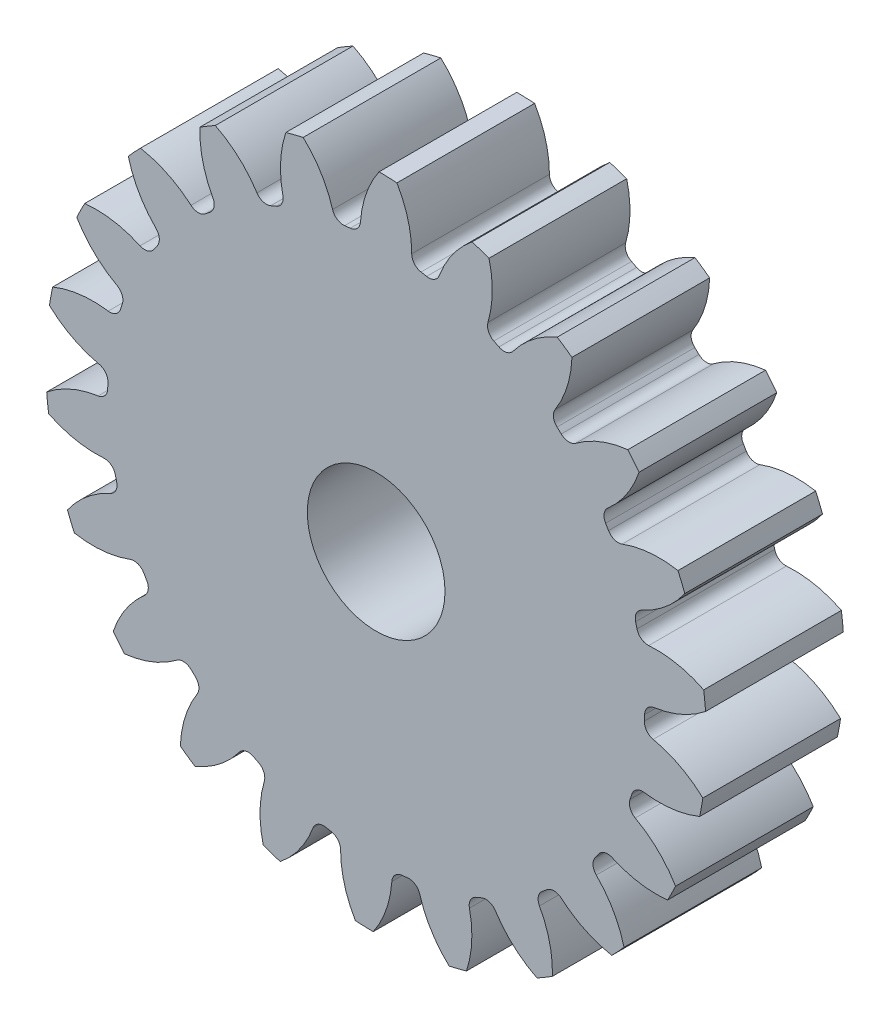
SolidWorks part; units mm, degrees
ref_plane "Front" through (0, 0, 0) normal (0, 0, 1) x (1, 0, 0)
ref_plane "Top" through (0, 0, 0) normal (0, 1, 0) x (1, 0, 0)
ref_plane "Right" through (0, 0, 0) normal (1, 0, 0) x (0, 0, -1)
sketch "Sketch3" plane through (0, 0, 0) normal (0, 0, 1) x (1, 0, 0)
  circle A0 centre (0, 0) radius 243.84
  dimension "od" = 487.68
extrude "gearBody" add sketch "Sketch3" along normal blind 101.6
sketch "Sketch2" plane through (0, 0, 0) normal (0, 0, 1) x (1, 0, 0)
  line L0 (0, 0) -> (194.0517, 80.3789) construction
  line L1 (241.7736, -37.5132) -> (0, 0) construction
  line L2 (0, 0) -> (36.3143, 0) construction
  line L3 (223.3803, 7.9014) -> (222.2401, -23.8861) construction
  line L5 (222.8102, -7.9924) -> (0, 0) construction
  line L7 (0, 0) -> (210.0401, 0) construction
  arc A0 (210.005, 3.8371) -> (209.1904, -18.8739) centre (0, 0) ccw construction
  arc A1 (243.0622, 19.4599) -> (241.0433, -36.8251) centre (0, 0) ccw construction
  arc A2 (223.3803, 7.9014) -> (222.2401, -23.8861) centre (0, 0) ccw construction
  arc A3 (197.9058, -9.2095) -> (198.057, -4.994) centre (0, 0) ccw
  arc A4 (241.7736, -37.5132) -> (204.4096, -17.6752) centre (187.7939, -94.0759) ccw
  arc A5 (241.7736, -37.5132) -> (243.84, 20.0939) centre (0, 0) ccw
  arc A6 (243.84, 20.0939) -> (205.1507, 2.984) centre (194.0517, 80.3789) cw
  arc A7 (198.057, -4.994) -> (205.1507, 2.984) centre (206.3247, -5.2025) cw
  arc A8 (204.4096, -17.6752) -> (197.9058, -9.2095) centre (206.1671, -9.5939) cw
  point P6 (243.84, 20.0939)
  point P22 (241.7736, -37.5132)
  dimension "baseDia" = 420.0802
  dimension "od" = 487.68
  dimension "pd" = 447.04
  dimension "rd" = 396.24
  dimension "rFillet" = 8.2702
  dimension "pointX" = 243.84
  dimension "pointY" = 20.0939
  dimension "CTT" = 31.7875
  dimension "flankCenterAngle" = 22.5
extrude "toothCut" cut sketch "Sketch2" along normal through all
pattern_circular "CirPattern1" count 22 over 360 about axis through (0, 0, 0) along (0, 0, 1) of "toothCut"
sketch "hub1Dia" plane through (0, 0, 0) normal (0, 0, -1) x (-1, 0, 0)
  circle A0 centre (0, 0) radius 12.7
  dimension "hub1Dia" = 25.4
sketch "hub2Dia" plane through (0, 0, 101.6) normal (0, 0, 1) x (1, 0, 0)
  circle A0 centre (0, 0) radius 12.7
  dimension "hub2dia" = 25.4
sketch "boreDia" plane through (0, 0, 0) normal (0, 0, 1) x (1, 0, 0)
  circle A0 centre (0, 0) radius 50.8
  dimension "boreDia" = 101.6
extrude "bore" cut sketch "boreDia" against normal mid plane 25400
